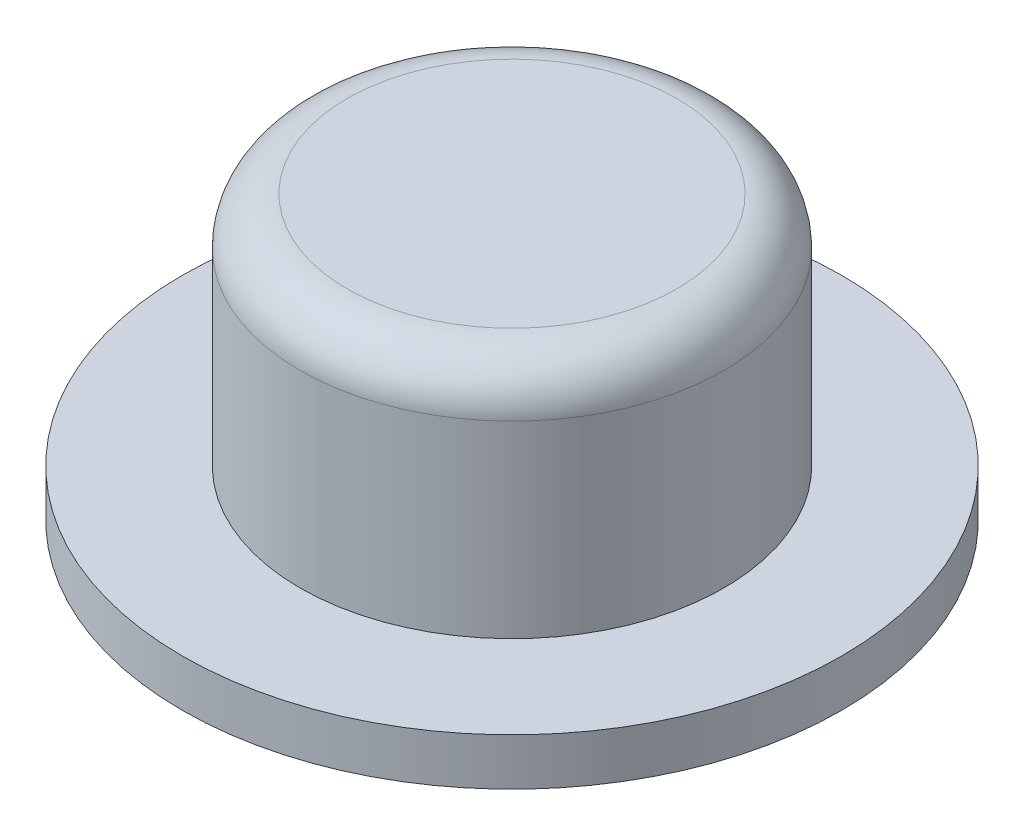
SolidWorks part; units mm, degrees
ref_plane "Front Plane" through (0, 0, 0) normal (0, 0, 1) x (1, 0, 0)
ref_plane "Top Plane" through (0, 0, 0) normal (0, 1, 0) x (1, 0, 0)
ref_plane "Right Plane" through (0, 0, 0) normal (1, 0, 0) x (0, 0, -1)
sketch "Sketch1" plane through (0, 0, 0) normal (0, 0, 1) x (1, 0, 0)
  line L0 (0, 0) -> (0, 6)
  line L1 (0, 6) -> (-3.5, 6)
  line L2 (-4.5, 5) -> (-4.5, 1)
  line L3 (-4.5, 1) -> (-7, 1)
  line L4 (-7, 1) -> (-7, 0)
  line L5 (-7, 0) -> (0, 0)
  arc A0 (-3.5, 6) -> (-4.5, 5) centre (-3.5, 5) ccw
  point P9 (-4.5, 6)
  dimension "D5" = 1
  dimension "D1" = 6
  dimension "D2" = 4.5
  dimension "D3" = 7
  dimension "D4" = 1
revolve "Center Button" add sketch "Sketch1" angle 360 about L0
